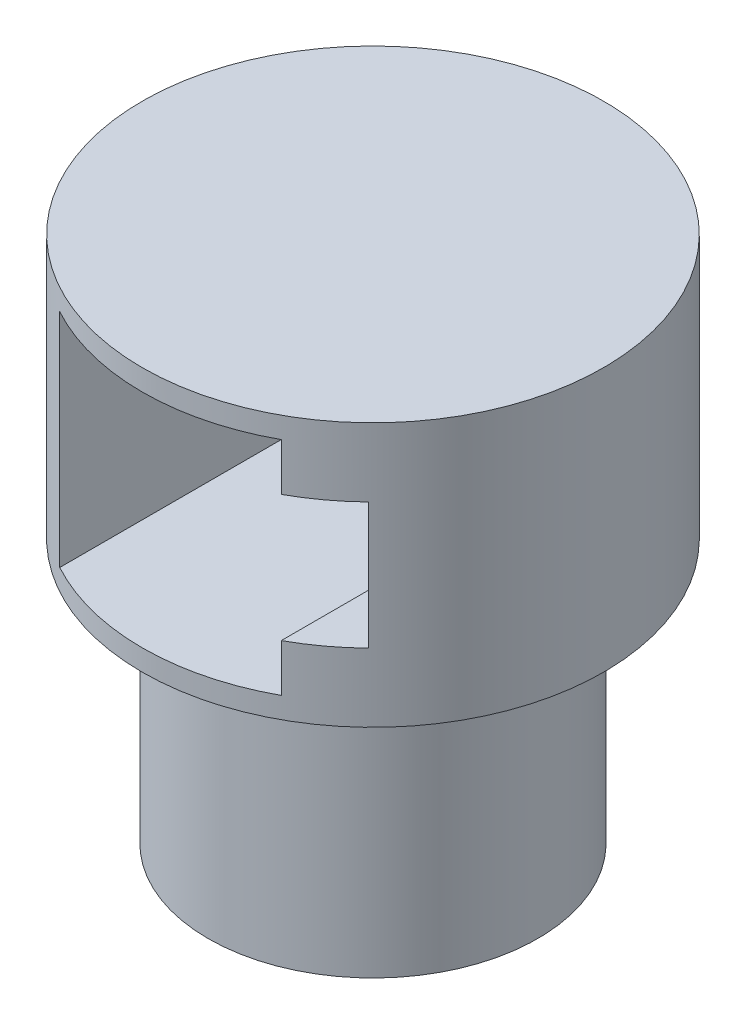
SolidWorks part; units mm, degrees
ref_plane "Front Plane" through (0, 0, 0) normal (0, 0, 1) x (1, 0, 0)
ref_plane "Top Plane" through (0, 0, 0) normal (0, 1, 0) x (1, 0, 0)
ref_plane "Right Plane" through (0, 0, 0) normal (1, 0, 0) x (0, 0, -1)
sketch "Sketch2" plane through (0, 0, 0) normal (0, 1, 0) x (1, 0, 0)
  circle A0 centre (0, 0) radius 31.75
  dimension "D1" = 63.5
extrude "Boss-Extrude1" add sketch "Sketch2" along normal blind 101.6
sketch "Sketch4" plane through (0, 0, 0) normal (0, -1, 0) x (-1, 0, 0)
  line L0 (1.8665, -1.905) -> (-1.8665, -1.905)
  circle A0 centre (0, 0) radius 2.667
  point P5 (0, 2.667)
  dimension "D1" = 5.334
  dimension "D2" = 4.572
extrude "Cut-Extrude1" cut sketch "Sketch4" against normal blind 25.4 contours L0 A0
sketch "Sketch18" plane through (0, 101.6, 0) normal (0, 1, 0) x (1, 0, 0)
  circle A0 centre (0, 0) radius 44.45
  dimension "D1" = 88.9
extrude "Boss-Extrude2" add sketch "Sketch18" against normal blind 50.8
sketch "Sketch16" plane through (0, 0, 0) normal (0, -1, 0) x (1, 0, 0)
  circle A0 centre (0, 0) radius 2.667
extrude "Cut-Extrude7" cut sketch "Sketch16" against normal blind 5.588 and the other way through all
ref_plane "Plane1" through (0, 0, 44.45) normal (0, 0, 1) x (1, 0, 0)
sketch "Sketch17" plane through (0, 0, 44.45) normal (0, 0, 1) x (1, 0, 0)
  line L0 (0, 101.6) -> (0, -7.012) construction
  line L1 (31.75, 101.6) -> (-31.75, 101.6) construction
  line L2 (-31.75, 76.2) -> (31.75, 76.2) construction
  line L3 (31.75, 0) -> (31.75, 50.8) construction
  line L4 (-21.336, 54.864) -> (21.336, 54.864)
  line L5 (-21.336, 54.864) -> (-21.336, 97.536)
  line L6 (-21.336, 97.536) -> (21.336, 97.536)
  line L7 (21.336, 54.864) -> (21.336, 97.536)
  line L8 (-21.336, 54.864) -> (21.336, 97.536) construction
  line L9 (-21.336, 97.536) -> (21.336, 54.864) construction
  line L10 (-31.75, 50.8) -> (-31.75, 0) construction
  line L12 (30.988, 64.008) -> (21.336, 64.008)
  line L13 (30.988, 64.008) -> (30.988, 88.392)
  line L14 (30.988, 88.392) -> (21.336, 88.392)
  line L15 (21.336, 64.008) -> (21.336, 88.392)
  line L16 (30.988, 64.008) -> (21.336, 88.392) construction
  line L17 (30.988, 88.392) -> (21.336, 64.008) construction
  circle A0 centre (0, 76.2) radius 25.4 construction
  point P9 (26.162, 76.2)
  dimension "D1" = 50.8
  dimension "D2" = 42.672
  dimension "D3" = 25.4
  dimension "D4" = 9.652
  dimension "D5" = 24.384
extrude "Cut-Extrude9" cut sketch "Sketch17" against normal blind 50.8 contours L4 L7 L6 L5 | L13 L14 L7 L12
sketch "Sketch19" plane through (0, 0, 44.45) normal (0, 0, 1) x (1, 0, 0)
  line L1 (-44.45, 101.6) -> (-44.45, 50.8) construction
  line L3 (44.45, 101.6) -> (-44.45, 101.6) construction
  line L4 (44.45, 50.8) -> (44.45, 101.6) construction
  line L5 (-44.45, 91.1398) -> (-53.7799, 91.1398)
  line L6 (-53.7799, 91.1398) -> (-53.7799, 102.7944)
  line L7 (-53.7799, 102.7944) -> (49.5673, 102.7944)
  line L8 (49.5673, 102.7944) -> (49.5673, 91.1398)
  line L9 (49.5673, 91.1398) -> (44.45, 91.1398)
  arc A0 (-44.45, 91.1398) -> (44.45, 91.1398) centre (0, 1.9261) cw
